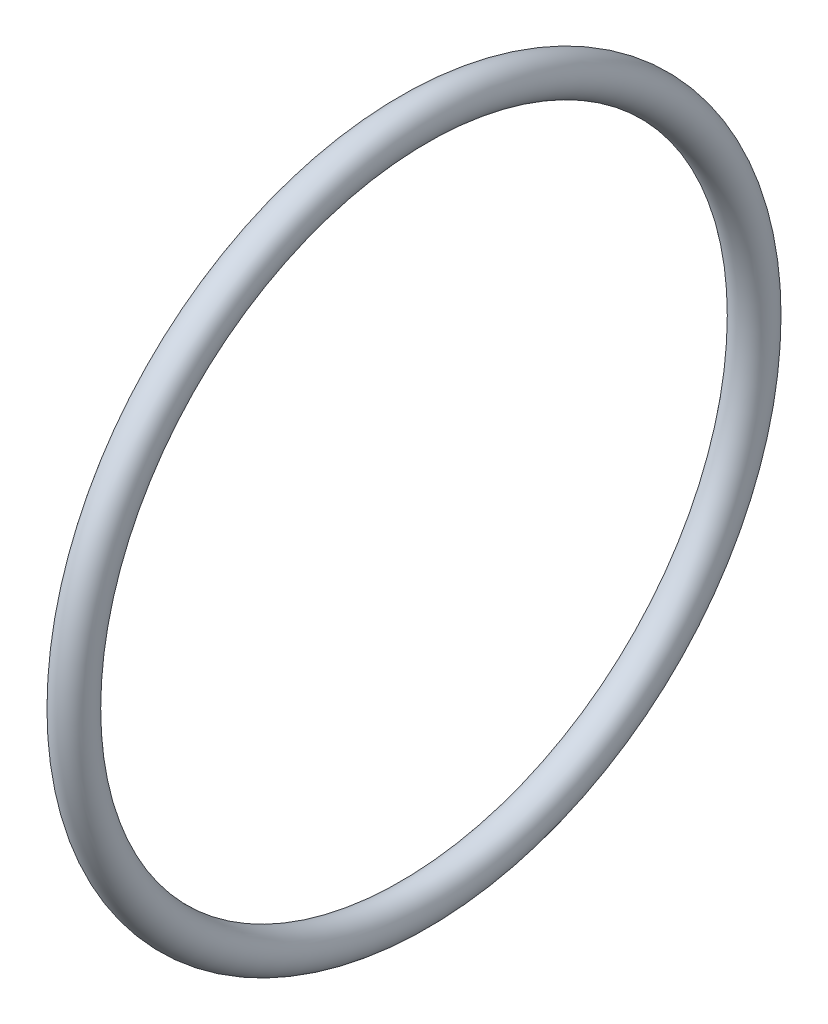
SolidWorks part; units mm, degrees
ref_plane "Plan de face" through (0, 0, 0) normal (0, 0, 1) x (1, 0, 0)
ref_plane "Plan de dessus" through (0, 0, 0) normal (0, 1, 0) x (1, 0, 0)
ref_plane "Plan de droite" through (0, 0, 0) normal (1, 0, 0) x (0, 0, -1)
sketch "Esquisse2" plane through (0, 0, 0) normal (0, 1, 0) x (-1, 0, 0)
  line L1 (0, 0) -> (-7.8086, 0) construction
  circle A0 centre (-2.493, 19.6818) radius 1.1
  circle A2 centre (-2.493, 19.6818) radius 0.7326
  dimension "D1" = 2.2
revolve "Révolution1" add sketch "Esquisse2" angle 360 about L1
